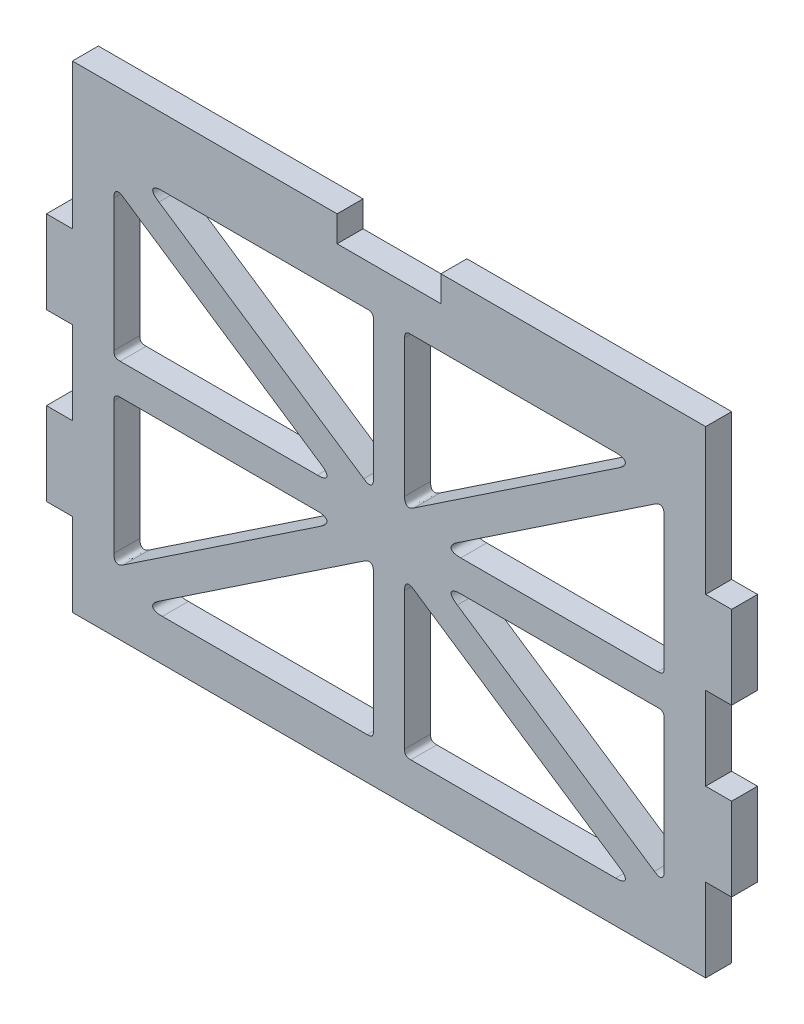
SolidWorks part; units mm, degrees
ref_plane "前视基准面" through (0, 0, 0) normal (0, 0, 1) x (1, 0, 0)
ref_plane "上视基准面" through (0, 0, 0) normal (0, 1, 0) x (1, 0, 0)
ref_plane "右视基准面" through (0, 0, 0) normal (1, 0, 0) x (0, 0, -1)
sketch "草图1" plane through (0, 0, 0) normal (0, 0, 1) x (1, 0, 0)
  line L1 (-30.5, 0) -> (30.5, 0)
  line L2 (-30.5, 0) -> (-30.5, 46)
  line L3 (-30.5, 46) -> (30.5, 46)
  line L4 (30.5, 0) -> (30.5, 46)
  dimension "D1" = 61
  dimension "D2" = 46
extrude "凸台-拉伸1" add sketch "草图1" along normal blind 2.5
sketch "草图2" plane through (0, 0, 2.5) normal (0, 0, 1) x (1, 0, 0)
  line L0 (0, 0) -> (0, 39.3441) construction
  line L1 (-30.5, 0) -> (30.5, 0) construction
  line L2 (30.5, 0) -> (30.5, 46) construction
  line L3 (30.5, 8) -> (33, 8)
  line L4 (30.5, 8) -> (30.5, 16)
  line L5 (30.5, 16) -> (33, 16)
  line L6 (33, 8) -> (33, 16)
  line L7 (-33, 24) -> (-33, 32)
  line L8 (30.5, 24) -> (33, 24)
  line L9 (30.5, 24) -> (30.5, 32)
  line L10 (30.5, 32) -> (33, 32)
  line L11 (33, 24) -> (33, 32)
  line L12 (-30.5, 32) -> (-33, 32)
  line L13 (-30.5, 24) -> (-30.5, 32)
  line L14 (-30.5, 24) -> (-33, 24)
  line L15 (-33, 8) -> (-33, 16)
  line L16 (-30.5, 16) -> (-33, 16)
  line L17 (-30.5, 8) -> (-30.5, 16)
  line L18 (-30.5, 8) -> (-33, 8)
  dimension "D1" = 2.5
  dimension "D2" = 8
  dimension "D3" = 8
  dimension "D4" = 8
  dimension "D5" = 8
extrude "凸台-拉伸2" add sketch "草图2" against normal up to surface (2.5 mm away)
sketch "草图3" plane through (0, 0, 2.5) normal (0, 0, 1) x (1, 0, 0)
  line L0 (0, 0) -> (0, 46) construction
  line L1 (-30.5, 0) -> (30.5, 0) construction
  line L2 (30.5, 46) -> (-30.5, 46) construction
  line L4 (-5, 46) -> (5, 46)
  line L5 (-5, 46) -> (-5, 43.5)
  line L6 (-5, 43.5) -> (5, 43.5)
  line L7 (5, 46) -> (5, 43.5)
  dimension "D1" = 2.5
  dimension "D2" = 10
extrude "切除-拉伸1" cut sketch "草图3" against normal up to surface (2.5 mm away)
sketch "草图4" plane through (0, 0, 2.5) normal (0, 0, 1) x (1, 0, 0)
  line L0 (0, 0) -> (0, 43.5) construction
  line L1 (-30.5, 0) -> (30.5, 0) construction
  line L2 (-5, 43.5) -> (5, 43.5) construction
  line L3 (30.5, 16) -> (30.5, 24) construction
  line L4 (-26.5, 39.5) -> (26.5, 39.5) construction
  line L5 (-26.5, 39.5) -> (-26.5, 4) construction
  line L6 (-26.5, 4) -> (26.5, 4) construction
  line L7 (26.5, 39.5) -> (26.5, 4) construction
  line L8 (-26.5, 39.5) -> (26.5, 4) construction
  line L9 (-26.5, 4) -> (26.5, 39.5) construction
  line L10 (-23.8046, 39.5) -> (-1.5, 39.5)
  line L11 (-1.5, 39.5) -> (-1.5, 24.5601)
  line L12 (-1.5, 24.5601) -> (-23.8046, 39.5)
  line L13 (-26.5, 21.75) -> (26.5, 21.75) construction
  line L14 (1.5, 24.5601) -> (23.8046, 39.5)
  line L15 (1.5, 39.5) -> (1.5, 24.5601)
  line L16 (23.8046, 39.5) -> (1.5, 39.5)
  line L17 (23.8046, 4) -> (1.5, 4)
  line L18 (1.5, 4) -> (1.5, 18.9399)
  line L19 (1.5, 18.9399) -> (23.8046, 4)
  line L20 (-1.5, 18.9399) -> (-23.8046, 4)
  line L21 (-1.5, 4) -> (-1.5, 18.9399)
  line L22 (-23.8046, 4) -> (-1.5, 4)
  line L23 (-26.5, 37.6946) -> (-26.5, 23.25)
  line L24 (-26.5, 23.25) -> (-4.9348, 23.25)
  line L25 (-4.9348, 23.25) -> (-26.5, 37.6946)
  line L26 (-4.9348, 20.25) -> (-26.5, 5.8054)
  line L27 (-26.5, 20.25) -> (-4.9348, 20.25)
  line L28 (-26.5, 5.8054) -> (-26.5, 20.25)
  line L29 (26.5, 5.8054) -> (26.5, 20.25)
  line L30 (26.5, 20.25) -> (4.9348, 20.25)
  line L31 (4.9348, 20.25) -> (26.5, 5.8054)
  line L32 (4.9348, 23.25) -> (26.5, 37.6946)
  line L33 (26.5, 23.25) -> (4.9348, 23.25)
  line L34 (26.5, 37.6946) -> (26.5, 23.25)
  dimension "D1" = 4
  dimension "D2" = 4
  dimension "D3" = 4
  dimension "D4" = 1.5
  dimension "D5" = 1.5
  dimension "D6" = 1.5
  dimension "D7" = 1.5
extrude "切除-拉伸2" cut sketch "草图4" against normal up to surface (2.5 mm away)
fillet "圆角1" radius 0.6 24 edges at (-23.8046, 4, 1.25) (-26.5, 5.8054, 1.25) (-26.5, 20.25, 1.25) (-4.9348, 20.25, 1.25) (-1.5, 18.9399, 1.25) (-1.5, 4, 1.25) (1.5, 4, 1.25) (1.5, 18.9399, 1.25) (23.8046, 4, 1.25) (26.5, 5.8054, 1.25) (26.5, 20.25, 1.25) (4.9348, 20.25, 1.25) (4.9348, 23.25, 1.25) (26.5, 23.25, 1.25) (26.5, 37.6946, 1.25) (23.8046, 39.5, 1.25) (1.5, 24.5601, 1.25) (1.5, 39.5, 1.25) (-1.5, 39.5, 1.25) (-1.5, 24.5601, 1.25) (-4.9348, 23.25, 1.25) (-26.5, 23.25, 1.25) (-26.5, 37.6946, 1.25) (-23.8046, 39.5, 1.25)
